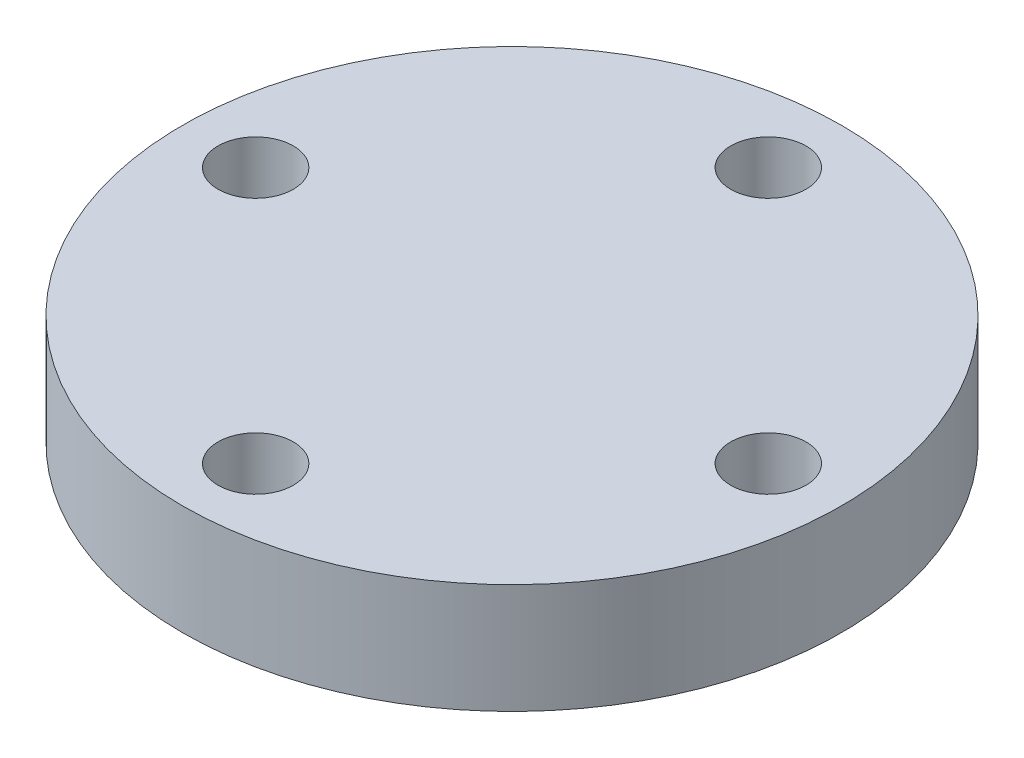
SolidWorks part; units mm, degrees
ref_plane "Front Plane" through (0, 0, 0) normal (0, 0, 1) x (1, 0, 0)
ref_plane "Top Plane" through (0, 0, 0) normal (0, 1, 0) x (1, 0, 0)
ref_plane "Right Plane" through (0, 0, 0) normal (1, 0, 0) x (0, 0, -1)
sketch "Sketch1" plane through (0, 0, 0) normal (0, 1, 0) x (1, 0, 0)
  circle A0 centre (0, 0) radius 28.575
  dimension "D1" = 57.15
extrude "Boss-Extrude1" add sketch "Sketch1" along normal blind 9.525
sketch "Sketch2" plane through (0, 9.525, 0) normal (0, 1, 0) x (1, 0, 0)
  line L0 (0, 36.3098) -> (0, -42.0054) construction
  line L1 (-46.551, 0) -> (44.0318, 0) construction
  circle A0 centre (0, 0) radius 22.225 construction
  circle A1 centre (0, 22.225) radius 3.2639
  circle A2 centre (22.225, 0) radius 3.2639
  circle A3 centre (0, -22.225) radius 3.2639
  circle A4 centre (-22.225, 0) radius 3.2639
  point P18 (0, 0)
  dimension "D1" = 44.45
  dimension "D3" = 6.5278
  dimension "D2" = 4
extrude "Cut-Extrude1" cut sketch "Sketch2" against normal through all
